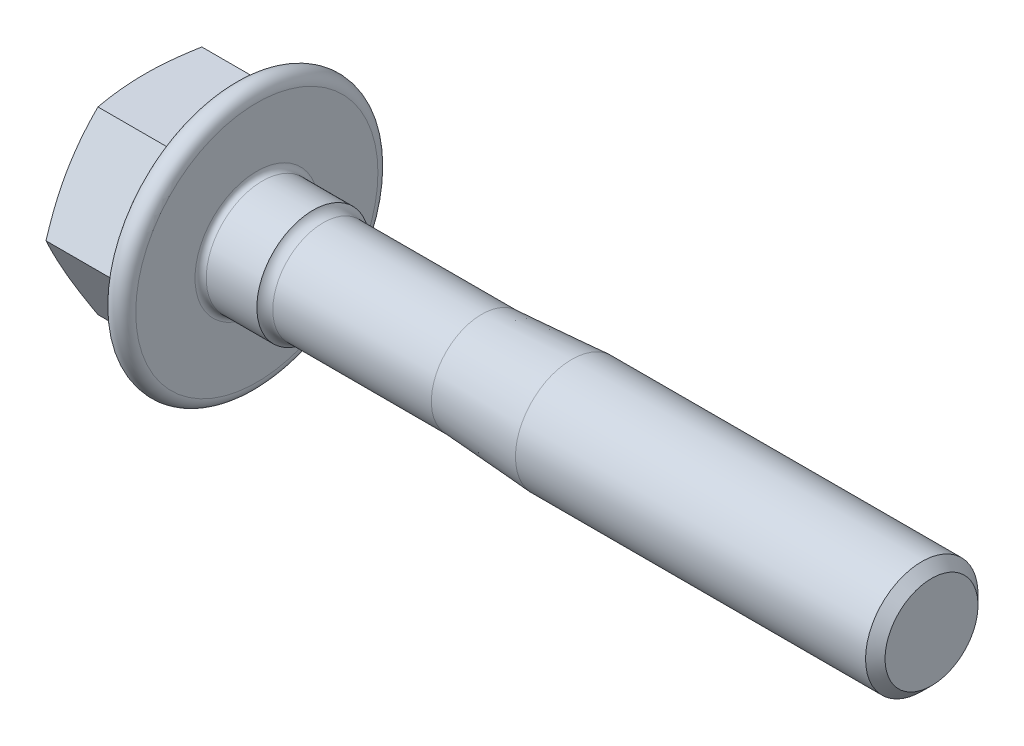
SolidWorks part; units mm, degrees
ref_plane "Front" through (0, 0, 0) normal (0, 0, 1) x (1, 0, 0)
ref_plane "Top" through (0, 0, 0) normal (0, 1, 0) x (1, 0, 0)
ref_plane "Right" through (0, 0, 0) normal (1, 0, 0) x (0, 0, -1)
sketch "Sketch1" plane through (0, 0, 0) normal (1, 0, 0) x (0, 0, -1)
  line L1 (4.6188, 0) -> (2.3094, 4)
  line L2 (2.3094, 4) -> (-2.3094, 4)
  line L3 (-2.3094, 4) -> (-4.6188, 0)
  line L4 (-4.6188, 0) -> (-2.3094, -4)
  line L5 (-2.3094, -4) -> (2.3094, -4)
  line L6 (2.3094, -4) -> (4.6188, 0)
  circle A0 centre (0, 0) radius 4 construction
  dimension "s" = 8
extrude "BaseHead" add sketch "Sketch1" along normal blind 5.4
sketch "Sketch2" plane through (5.4, 0, 0) normal (1, 0, 0) x (0, 0, -1)
  circle A0 centre (0, 0) radius 2.5
  dimension "d" = 5
extrude "BaseBody" add sketch "Sketch2" along normal blind 30
sketch "Sketch3" plane through (2.9494, 0, 2.8241) normal (0, 1, 0) x (0, 0, -1)
  line L0 (7.4429, 2.9494) -> (7.4429, 2.3056)
  line L2 (7.4429, 2.3056) -> (5.6741, 2.9494)
  line L4 (5.6741, 2.9494) -> (7.4429, 2.9494)
  line L5 (2.8241, 3.9387) -> (2.8241, 2.4525) construction
  dimension "D1" = 20
  dimension "da" = 5.7
revolve "HeadChamfer" cut sketch "Sketch3" angle 360 about L5
sketch "Sketch5" plane through (-0.1752, 0, 7.2752) normal (0, 1, 0) x (0, 0, -1)
  line L0 (7.2752, -5.5752) -> (7.2752, -7.1738) construction
  line L1 (7.2752, -35.5752) -> (7.2752, -5.5752) construction
  line L2 (7.2752, -5.5752) -> (12.6596, -5.5752)
  line L3 (12.8359, -4.5752) -> (7.2752, -2.5512)
  line L4 (7.2752, -2.5512) -> (7.2752, -5.5752)
  line L5 (11.894, -5.5752) -> (9.5846, -5.5752) construction
  arc A0 (12.6596, -5.5752) -> (12.8359, -4.5752) centre (12.6596, -5.0596) ccw
  dimension "D3" = 20
  dimension "c" = 1
  dimension "dc" = 11.8
revolve "Flange" add sketch "Sketch5" angle 360 about L0
fillet "HeadFillet" radius 0.25 1 edges at (5.4, 0, -2.5)
fillet "FlangeHexFillet" radius 0.3 6 edges
chamfer "Chamfer1" distance 0.433 angle 45 1 edges at (35.4, 0, -2.5)
sketch "Sketch6" plane through (-28.3278, 0, -3) normal (0, 1, 0) x (-1, 0, 0)
  line L0 (-36.2278, 5.5) -> (-36.2278, 5.24)
  line L1 (-33.7278, 8.3845) -> (-33.7278, -2.3845) construction
  line L2 (-36.2278, 5.24) -> (-43.7278, 5.24)
  line L3 (-43.7278, 5.24) -> (-47.7278, 5.5)
  line L4 (-47.7278, 5.5) -> (-36.2278, 5.5)
  line L5 (-33.9778, 5.5) -> (-63.2948, 5.5) construction
  line L6 (-48.9486, 3) -> (-26.9469, 3) construction
  line L7 (-63.2948, 3) -> (-33.9778, 3) construction
  dimension "1d" = 2.5
  dimension "ls" = 10
  dimension "lg" = 14
  dimension "dr" = 4.48
revolve "Cut-Revolve1" cut sketch "Sketch6" angle 360 about L6
fillet "Fillet1" radius 0.52 1 edges at (7.9, 0, -2.24)
equation "\"D1@Chamfer1\" =  ( \"d@Sketch2\" - \"D2@ThreadCosmetic1\" ) / 2"
equation "\"1d@Sketch6\" = \"d@Sketch2\"*0.5"
equation "\"D1@Fillet1\"=(\"d@Sketch2\"-\"dr@Sketch6\")"
